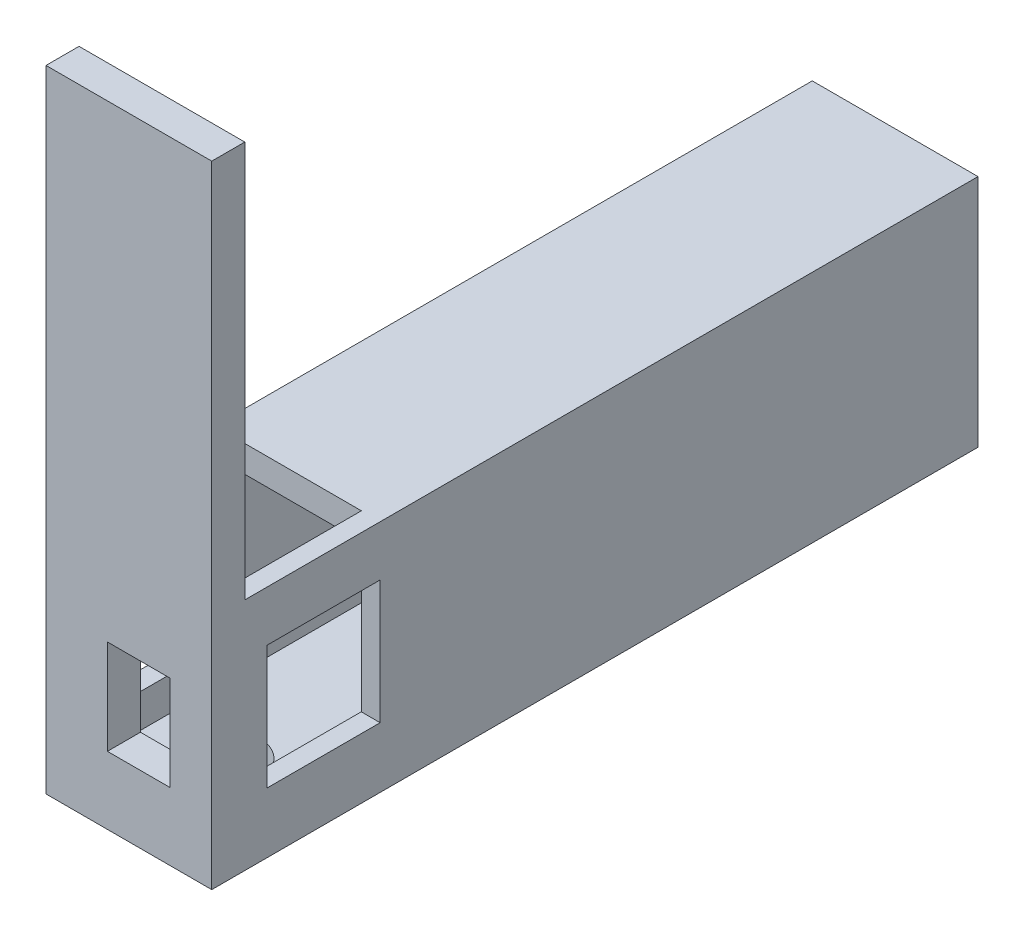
SolidWorks part; units mm, degrees
ref_plane "Front Plane" through (0, 0, 0) normal (0, 0, 1) x (1, 0, 0)
ref_plane "Top Plane" through (0, 0, 0) normal (0, 1, 0) x (1, 0, 0)
ref_plane "Right Plane" through (0, 0, 0) normal (1, 0, 0) x (0, 0, -1)
sketch "Sketch1" plane through (0, 0, 0) normal (0, 0, 1) x (1, 0, 0)
  line L1 (-25.6079, 147.5908) -> (24.554, 147.5908)
  line L2 (-25.6079, 147.5908) -> (-25.6079, 218.5369)
  line L3 (-25.6079, 218.5369) -> (24.554, 218.5369)
  line L4 (24.554, 147.5908) -> (24.554, 218.5369)
  line L5 (-25.6079, 147.5908) -> (24.554, 218.5369) construction
  line L6 (-25.6079, 218.5369) -> (24.554, 147.5908) construction
  line L7 (-19.897, 155.668) -> (18.8432, 155.668)
  line L8 (-19.897, 155.668) -> (-19.897, 210.4598)
  line L9 (-19.897, 210.4598) -> (18.8432, 210.4598)
  line L10 (18.8432, 155.668) -> (18.8432, 210.4598)
  line L11 (-19.897, 155.668) -> (18.8432, 210.4598) construction
  line L12 (-19.897, 210.4598) -> (18.8432, 155.668) construction
  point P0 (-0.5269, 183.0639)
  point P5 (-0.5269, 183.0639)
extrude "Boss-Extrude1" add sketch "Sketch1" against normal blind 221.8957
sketch "Sketch2" plane through (0, 218.5369, 0) normal (0, 1, 0) x (1, 0, 0)
  line L0 (24.554, 0) -> (-25.6079, 0) construction
  line L1 (-19.897, 0) -> (18.8432, 0)
  line L2 (-19.897, 0) -> (-19.897, 41)
  line L3 (-19.897, 41) -> (18.8432, 41)
  line L4 (18.8432, 0) -> (18.8432, 41)
  line L5 (-19.897, 221.8957) -> (-19.897, 0) construction
  line L6 (18.8432, 221.8957) -> (18.8432, 0) construction
  dimension "D1" = 41
extrude "Boss-Extrude2" add sketch "Sketch2" along normal blind 25.8807
sketch "Sketch3" plane through (0, 147.5908, 0) normal (0, -1, 0) x (1, 0, 0)
  circle A0 centre (0, -18.05) radius 10.8503
extrude "Cut-Extrude1" cut sketch "Sketch3" against normal blind 18.4
sketch "Sketch4" plane through (-25.6079, 0, 0) normal (-1, 0, 0) x (0, 0, 1)
  line L1 (-40.9599, 165.8676) -> (-6.6928, 165.8676)
  line L2 (-40.9599, 165.8676) -> (-40.9599, 203.2887)
  line L3 (-40.9599, 203.2887) -> (-6.6928, 203.2887)
  line L4 (-6.6928, 165.8676) -> (-6.6928, 203.2887)
extrude "Cut-Extrude2" cut sketch "Sketch4" against normal blind 111.6
sketch "Sketch5" plane through (0, 0, 0) normal (0, 0, 1) x (1, 0, 0)
  line L1 (-25.6079, 218.5369) -> (24.554, 218.5369)
  line L2 (-25.6079, 218.5369) -> (-25.6079, 147.5908)
  line L3 (-25.6079, 147.5908) -> (24.554, 147.5908)
  line L4 (24.554, 218.5369) -> (24.554, 147.5908)
extrude "Boss-Extrude3" add sketch "Sketch5" along normal blind 10
sketch "Sketch6" plane through (0, 218.5369, 0) normal (0, 1, 0) x (1, 0, 0)
  line L0 (24.554, 221.8957) -> (24.554, -10) construction
  line L1 (-25.6079, -10) -> (24.554, -10)
  line L2 (-25.6079, -10) -> (-25.6079, 0)
  line L3 (-25.6079, 0) -> (24.554, 0)
  line L4 (24.554, -10) -> (24.554, 0)
  line L5 (18.8432, 0) -> (-19.897, 0) construction
extrude "Boss-Extrude4" add sketch "Sketch6" along normal blind 120
sketch "Sketch7" plane through (0, 0, 10) normal (0, 0, 1) x (1, 0, 0)
  line L1 (-7.029, 168.0538) -> (11.9813, 168.0538)
  line L2 (-7.029, 168.0538) -> (-7.029, 196.7237)
  line L3 (-7.029, 196.7237) -> (11.9813, 196.7237)
  line L4 (11.9813, 168.0538) -> (11.9813, 196.7237)
extrude "Cut-Extrude3" cut sketch "Sketch7" against normal blind 41.6
